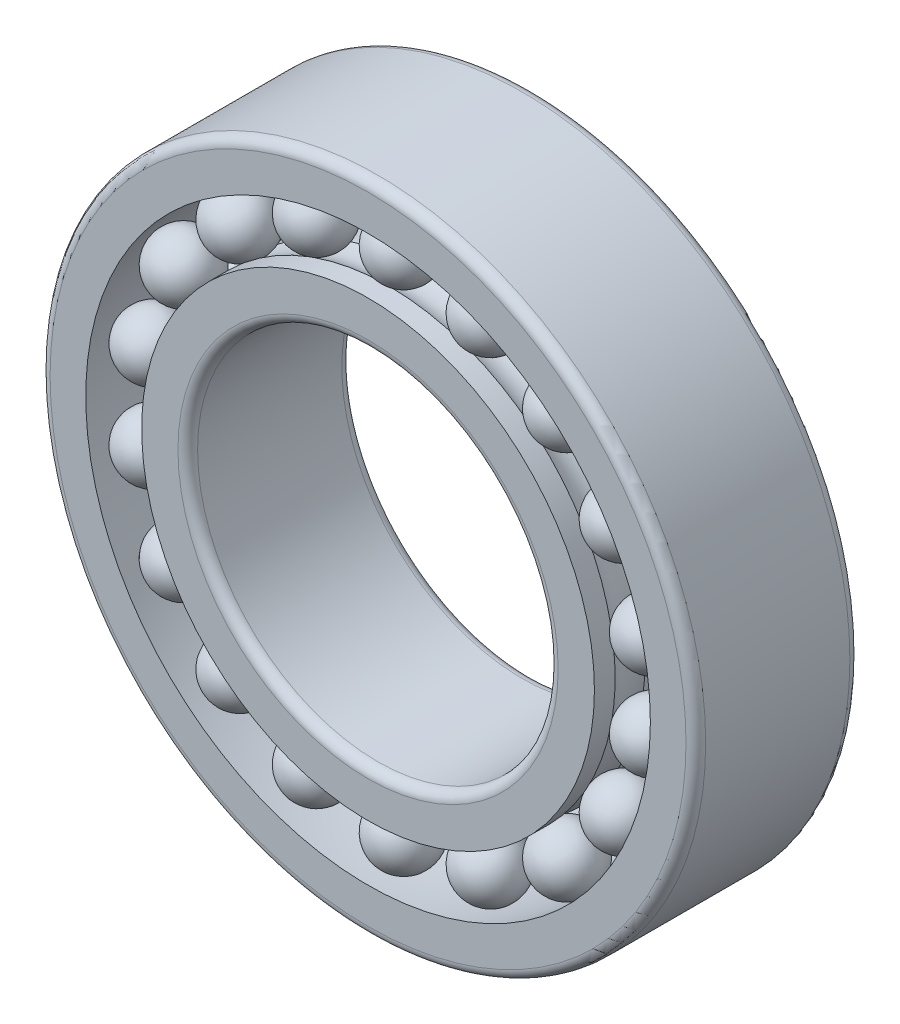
SolidWorks part; units mm, degrees
ref_plane "Front Plane" through (0, 0, 0) normal (0, 0, 1) x (1, 0, 0)
ref_plane "Top Plane" through (0, 0, 0) normal (0, 1, 0) x (1, 0, 0)
ref_plane "Right Plane" through (0, 0, 0) normal (1, 0, 0) x (0, 0, -1)
sketch "BaseSke" plane through (0, 0, 0) normal (1, 0, 0) x (0, 0, -1)
  line L0 (-47.2296, 0) -> (24.6132, 0) construction
  line L1 (-47.2296, 38.75) -> (24.6132, 38.75) construction
  line L2 (0, 129.5214) -> (0, -86.3012) construction
  line L3 (-7.0673, 43.5577) -> (-7.0673, 33.9423)
  line L4 (-12.5, 50) -> (12.5, 50) construction
  line L5 (-12.5, 27.5) -> (12.5, 27.5) construction
  line L6 (-12.5, 50) -> (-12.5, 27.5) construction
  line L7 (12.5, 50) -> (12.5, 27.5) construction
  line L8 (-11.875, 50) -> (-11.875, 27.5) construction
  arc A0 (-7.0673, 43.5577) -> (-7.0673, 33.9423) centre (-7.0673, 38.75) ccw
  dimension "D2" = 0.625
  dimension "Ball_diameter" = 9.6154
  dimension "D1" = 38.75
  dimension "Bearing_Thickness" = 25
  dimension "Bearing_Outside_Diameter" = 100
  dimension "Bearing_Inside_Diameter" = 55
revolve "Ball" add sketch "BaseSke" angle 360 about L3
sketch "OuterRaceSke" plane through (0, 0, 0) normal (1, 0, 0) x (0, 0, -1)
  line L0 (0, 0) -> (0, 87.5396) construction
  line L1 (-12.5, 50) -> (12.5, 50)
  line L2 (-12.5, 50) -> (-12.5, 43.0628)
  line L4 (12.5, 50) -> (12.5, 43.0628)
  line L5 (-50.3916, 0) -> (55.2197, 0) construction
  arc A0 (-12.5, 43.0628) -> (12.5, 43.0628) centre (0, -66.2247) cw
  arc A1 (-12.5, 43.0829) -> (12.5, 43.0829) centre (0, -66.2247) cw construction
  arc A2 (-7.0673, 43.5577) -> (-7.0673, 33.9423) centre (-7.0673, 38.75) ccw construction
  dimension "D1" = 110
  dimension "D2" = 0.02
revolve "OuterRace" add sketch "OuterRaceSke" angle 360 about L5
mirror "MirrorBall" about plane through (0, 0, 0) normal (0, 0, 1) of "Ball"
sketch "InnerRaceSke" plane through (0, 0, 0) normal (1, 0, 0) x (0, 0, -1)
  line L0 (-70.8626, 0) -> (113.5527, 0) construction
  line L1 (0, 58.441) -> (0, -70.8113) construction
  line L2 (-12.5, 27.5) -> (12.5, 27.5)
  line L3 (-12.5, 27.5) -> (-12.5, 34.5312)
  line L4 (-12.5, 34.5312) -> (-9.352, 34.5313)
  line L5 (12.5, 27.5) -> (12.5, 34.5312)
  line L6 (0, 129.5214) -> (0, -86.3012) construction
  line L7 (-4.7826, 34.5313) -> (4.7826, 34.5313)
  line L8 (12.5, 34.5312) -> (9.352, 34.5313)
  arc A0 (-9.352, 34.5313) -> (-4.7826, 34.5313) centre (-7.0673, 38.75) ccw
  circle A1 centre (-7.0673, 38.75) radius 4.8077 construction
  arc A2 (9.352, 34.5313) -> (4.7826, 34.5313) centre (7.0673, 38.75) cw
  point P17 (0, 27.5)
  point P23 (0, 34.5312)
  dimension "D2" = 9.5954
  dimension "D1" = 69.0625
revolve "InnerRace" add sketch "InnerRaceSke" angle 360 about L0
fillet "Fillet1" radius 1.5 4 edges at (27.5, 0, -12.5) (27.5, 0, 12.5) (50, 0, -12.5) (50, 0, 12.5)
pattern_circular "CirPatternBall" count 18 over 360 about axis through (0, 0, 0) along (0, 0, 1) of "Ball", "MirrorBall"
sketch "TaperSke" plane through (0, 0, 0) normal (1, 0, 0) x (0, 0, -1)
  line L0 (-12.5, 27.5) -> (12.5, 27.5)
  line L1 (12.5, 27.5) -> (12.5, 29.5833)
  line L2 (12.5, 29.5833) -> (-12.5, 27.5)
  line L7 (-41.2502, 0) -> (40.8606, 0) construction
  dimension "Taper" = 2.0833
revolve "Taper" [suppressed] cut sketch "TaperSke" angle 360 about L7
fillet "Fillet2" [suppressed] radius 1.5
sketch "SimplifiedSke" plane through (0, 0, 0) normal (1, 0, 0) x (0, 0, -1)
  line L0 (37.5911, 0) -> (-37.5911, 0) construction
  line L1 (0, 0) -> (0, 72.9012) construction
  circle A0 centre (-7.0673, 38.75) radius 4.8077
  circle A1 centre (-7.0673, 38.75) radius 4.8077 construction
  circle A2 centre (7.0673, 38.75) radius 4.8077
revolve "Simplified" [suppressed] add sketch "SimplifiedSke" angle 360 about L0
equation "\"D1@BaseSke\" =  (\"Bearing_Outside_Diameter@BaseSke\"  +  \"Bearing_Inside_Diameter@BaseSke\"  )  / 4"
equation "\"Ball_diameter@BaseSke\" = \"Bearing_Thickness@BaseSke\" / 2.6"
equation "\"D2@BaseSke\" = \"Bearing_Thickness@BaseSke\"/40"
equation "\"D1@OuterRaceSke\" = \"Bearing_Inside_Diameter@BaseSke\"*2"
equation "\"D1@InnerRaceSke\" = \"Bearing_Inside_Diameter@BaseSke\" +  ( \"Bearing_Outside_Diameter@BaseSke\" - \"Bearing_Inside_Diameter@BaseSke\" )  / 3.2"
equation "\"D2@InnerRaceSke\" = \"Ball_diameter@BaseSke\"-0.02"
equation "\"D1@CirPatternBall\" = int( \"D1@BaseSke\"* pi  * 2 / \"Ball_diameter@BaseSke\" /1.4)"
equation "\"Taper@TaperSke\" = \"Bearing_Thickness@BaseSke\"/12"
equation "\"D1@Fillet2\" = \"Fillet_radius@Fillet1\""
